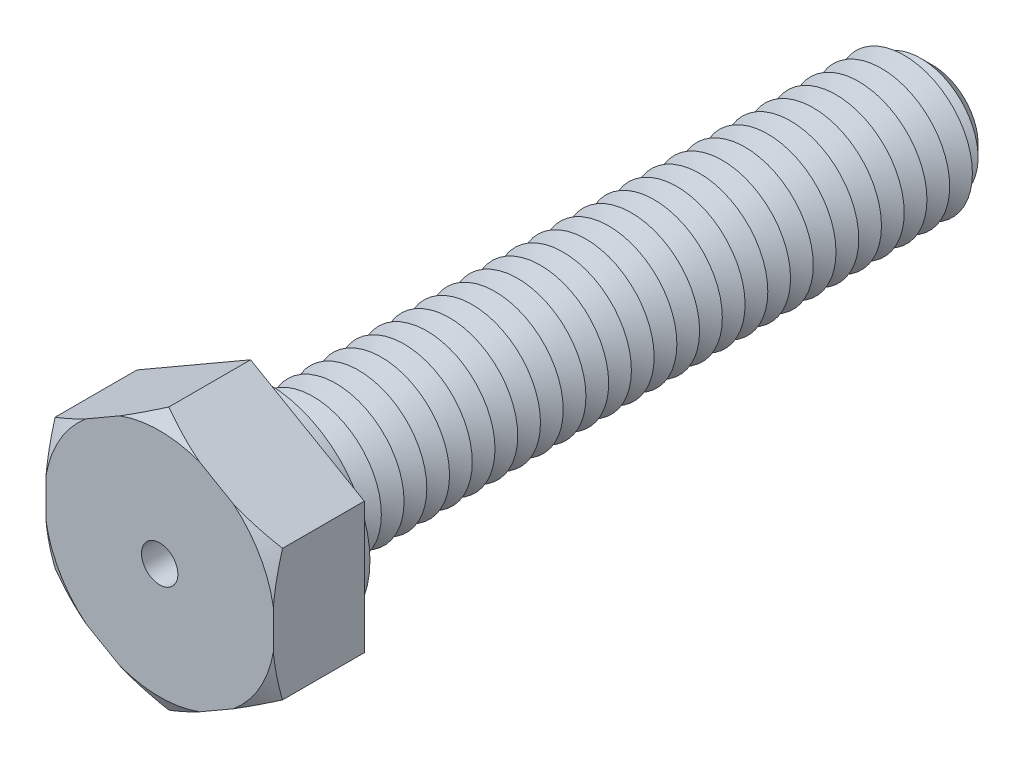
SolidWorks part; units mm, degrees
ref_plane "Front Plane" through (0, 0, 0) normal (0, 0, 1) x (1, 0, 0)
ref_plane "Top Plane" through (0, 0, 0) normal (0, 1, 0) x (1, 0, 0)
ref_plane "Right Plane" through (0, 0, 0) normal (1, 0, 0) x (0, 0, -1)
sketch "Sketch2" plane through (0, 0, 0) normal (0, 0, 1) x (1, 0, 0)
  line L1 (0, 5.7735) -> (-5, 2.8868)
  line L2 (-5, 2.8868) -> (-5, -2.8868)
  line L3 (-5, -2.8868) -> (0, -5.7735)
  line L4 (0, -5.7735) -> (5, -2.8868)
  line L5 (5, -2.8868) -> (5, 2.8868)
  line L6 (5, 2.8868) -> (0, 5.7735)
  circle A0 centre (0, 0) radius 5 construction
  dimension "D1" = 10
extrude "Boss-Extrude1" add sketch "Sketch2" along normal blind 4
sketch "Sketch3" plane through (0, 0, 0) normal (0, 0, -1) x (-1, 0, 0)
  circle A0 centre (0, 0) radius 3
  dimension "D1" = 6
extrude "Boss-Extrude2" add sketch "Sketch3" along normal blind 30
sketch "Sketch4" plane through (0, 0, 0) normal (0, 0, -1) x (-1, 0, 0)
  circle A0 centre (0, 0) radius 4.5
  dimension "D1" = 9
extrude "Boss-Extrude3" add sketch "Sketch4" along normal blind 0.75
sketch "Sketch5" plane through (0, 0, 0) normal (1, 0, 0) x (0, 0, -1)
  line L0 (-3.2117, 0) -> (6.3192, 0) construction
chamfer "Chamfer1" distance 1 angle 45 1 edges at (-3, 0, -30)
sketch "Sketch6" plane through (0, 0, 0) normal (1, 0, 0) x (0, 0, -1)
  line L0 (0.75, 3) -> (1.25, 2.134)
  line L1 (1.25, 2.134) -> (1.75, 3)
  line L2 (29, 3) -> (0.75, 3) construction
  line L3 (1.75, 3) -> (0.75, 3)
  dimension "D1" = 1
revolve "Cut-Revolve1" cut sketch "Sketch6" angle 360 about L0
pattern_linear "LPattern1" count 29 spacing 1 along (0, 0, -1) of "Cut-Revolve1"
sketch "Sketch7" plane through (0, 0, 0) normal (1, 0, 0) x (0, 0, -1)
  line L0 (-4, 5.7735) -> (-4, 5.0735)
  line L1 (-4, 2.8868) -> (-4, 5.7735) construction
  line L2 (-4, 5.0735) -> (-3.5959, 5.7735)
  line L3 (-4, 5.7735) -> (0, 5.7735) construction
  line L4 (-3.5959, 5.7735) -> (-4, 5.7735)
  dimension "D1" = 0.7
  dimension "D2" = 30
revolve "Cut-Revolve2" cut sketch "Sketch7" angle 360 about L0
sketch "Sketch8" plane through (0, 0, 4) normal (0, 0, 1) x (1, 0, 0)
  circle A0 centre (0, 0) radius 0.8
  dimension "D1" = 1.6
extrude "Cut-Extrude1" cut sketch "Sketch8" against normal up to surface (34 mm away)
